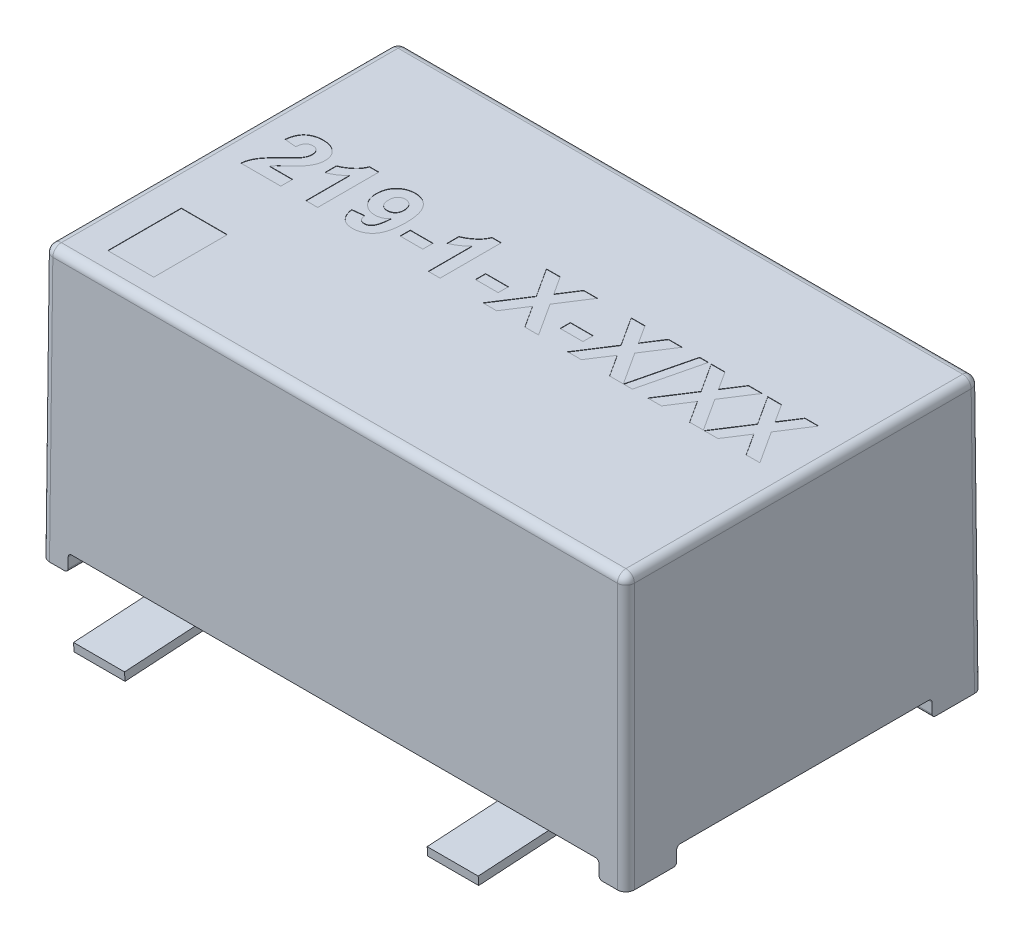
SolidWorks part; units mm, degrees
ref_plane "Front Plane" through (0, 0, 0) normal (0, 0, 1) x (1, 0, 0)
ref_plane "Top Plane" through (0, 0, 0) normal (0, 1, 0) x (1, 0, 0)
ref_plane "Right Plane" through (0, 0, 0) normal (1, 0, 0) x (0, 0, -1)
sketch "Sketch1" plane through (0, 0, 0) normal (0, 1, 0) x (1, 0, 0)
  line L1 (-8.6, -5.25) -> (8.6, -5.25)
  line L2 (-8.6, -5.25) -> (-8.6, 5.25)
  line L3 (-8.6, 5.25) -> (8.6, 5.25)
  line L4 (8.6, -5.25) -> (8.6, 5.25)
  line L5 (-8.6, -5.25) -> (8.6, 5.25) construction
  line L6 (-8.6, 5.25) -> (8.6, -5.25) construction
  point P0 (0, 0)
  dimension "D1" = 17.2
  dimension "D2" = 10.5
extrude "Main Body" add sketch "Sketch1" against normal blind 7.51
sketch "Sketch6" plane through (0, -7.51, 0) normal (0, -1, 0) x (1, 0, 0)
  line L0 (8.6, -5.25) -> (-8.6, -5.25) construction
  line L1 (8.1, 4.75) -> (-8.1, 4.75)
  line L2 (8.1, 4.75) -> (8.1, -4.75)
  line L3 (8.1, -4.75) -> (-8.1, -4.75)
  line L4 (-8.1, 4.75) -> (-8.1, -4.75)
  line L5 (8.1, 4.75) -> (-8.1, -4.75) construction
  line L6 (8.1, -4.75) -> (-8.1, 4.75) construction
  line L7 (-8.6, -5.25) -> (-8.6, 5.25) construction
  point P0 (0, 0)
  dimension "D1" = 0.5
  dimension "D2" = 0.5
sketch "Sketch2" plane through (0, -7.51, 0) normal (0, -1, 0) x (-1, 0, 0)
  line L1 (-8.1, -4.75) -> (-8.1, 4.75) construction
  line L17 (-8.6, 5.25) -> (-7.8, 5.25)
  line L18 (-8.6, 5.25) -> (8.6, 5.25) construction
  line L19 (-7.8, 5.25) -> (-7.8, 4.75)
  line L21 (-7.8, 4.75) -> (-8.1, 4.75)
  line L22 (-8.1, 4.75) -> (-8.1, 3.75)
  line L24 (-8.1, 3.75) -> (-8.6, 3.75)
  line L25 (-8.6, -5.25) -> (-8.6, 5.25) construction
  line L26 (-8.6, 3.75) -> (-8.6, 5.25)
  dimension "D1" = 0.8
  dimension "D2" = 1.5
  dimension "D3" = 0.5
  dimension "D4" = 1
extrude "Stand off foot" add sketch "Sketch2" along normal blind 0.5
mirror "Stand off Mirror1" about plane through (0, 0, 0) normal (1, 0, 0) of "Stand off foot"
mirror "Stand off Mirror2" about plane through (0, 0, 0) normal (0, 0, 1) of "Stand off Mirror1", "Stand off foot"
draft "0.36deg Draft" type of draft neutral plane draft angle 0.36 faces to draft 12 parameters "D1"=0.36
fillet "0.25mm Fillet1" radius 0.25 8 edges at (0, 0, -5.1997) (0, 0, 5.1997) (8.5497, 0, 0) (-8.5497, 0, 0) (-8.5748, -4.005, -5.2248) (-8.5748, -4.005, 5.2248) (8.5748, -4.005, 5.2248) (8.5748, -4.005, -5.2248)
draft "0.36 Inner Wall Draft" type of draft neutral plane draft angle 0.36 faces to draft 4 parameters "D1"=0.36
draft "0.36 Stand off Foot Draft" type of draft neutral plane draft angle 0.36 faces to draft 8 parameters "D1"=0.36
fillet "0.20mm Fillet1" radius 0.1 16 edges at (-8.3484, -7.51, -3.7531) (-8.3516, -8.01, -3.7563) (-7.8063, -8.01, -5) (-7.8031, -7.51, -4.9984) (7.8031, -7.51, -4.9984) (7.8063, -8.01, -5.0016) (8.3484, -7.51, -3.7531) (8.3516, -8.01, -3.7563) (8.3484, -7.51, 3.7531) (8.35, -8.01, 3.7563) (7.8031, -7.51, 4.9984) (7.8063, -8.01, 5) (-7.8063, -8.01, 5.0016) (-8.35, -8.01, 3.7563) (-8.3484, -7.51, 3.7531) (-7.8031, -7.51, 4.9984)
sketch "Sketch7" plane through (0, -7.51, 0) normal (0, -1, 0) x (1, 0, 0)
  line L0 (7.7038, -5.2469) -> (-7.7038, -5.2469) construction
  line L1 (7.55, -4.2069) -> (6.05, -4.2069)
  line L2 (7.55, -4.2069) -> (7.55, -3.9569)
  line L3 (7.55, -3.9569) -> (6.05, -3.9569)
  line L4 (6.05, -4.2069) -> (6.05, -3.9569)
  line L5 (2.85, -4.2069) -> (1.35, -4.2069)
  line L6 (2.85, -4.2069) -> (2.85, -3.9569)
  line L7 (2.85, -3.9569) -> (1.35, -3.9569)
  line L8 (1.35, -4.2069) -> (1.35, -3.9569)
  line L9 (-1.35, -4.2069) -> (-2.85, -4.2069)
  line L10 (-1.35, -4.2069) -> (-1.35, -3.9569)
  line L11 (-1.35, -3.9569) -> (-2.85, -3.9569)
  line L12 (-2.85, -4.2069) -> (-2.85, -3.9569)
  line L13 (-6.05, -4.2069) -> (-7.55, -4.2069)
  line L14 (-6.05, -4.2069) -> (-6.05, -3.9569)
  line L15 (-6.05, -3.9569) -> (-7.55, -3.9569)
  line L16 (-7.55, -4.2069) -> (-7.55, -3.9569)
  line L17 (5.95, 3.9569) -> (4.45, 3.9569)
  line L18 (5.95, 3.9569) -> (5.95, 4.2069)
  line L19 (5.95, 4.2069) -> (4.45, 4.2069)
  line L20 (4.45, 3.9569) -> (4.45, 4.2069)
  line L21 (-4.45, 3.9569) -> (-5.95, 3.9569)
  line L22 (-4.45, 3.9569) -> (-4.45, 4.2069)
  line L23 (-4.45, 4.2069) -> (-5.95, 4.2069)
  line L24 (-5.95, 3.9569) -> (-5.95, 4.2069)
  line L25 (8.6, -5) -> (8.6, -3.8557) construction
  line L26 (-8.6, -5) -> (-8.6, -3.8557) construction
  line L27 (-7.7038, 5.2469) -> (7.7038, 5.2469) construction
  line L28 (8.6, 5) -> (8.6, 3.8557) construction
  line L29 (-8.6, 5) -> (-8.6, 3.8557) construction
  point P34 (-5.95, 4.0819)
  dimension "D1" = 1.5
  dimension "D2" = 0.25
  dimension "D3" = 1.04
  dimension "D4" = 1.05
  dimension "D5" = 3.2
  dimension "D6" = 3.2
  dimension "D7" = 1.05
  dimension "D8" = 1.04
  dimension "D9" = 2.65
  dimension "D10" = 2.65
sketch "Sketch8" plane through (0, -7.51, 0) normal (0, -1, 0) x (-1, 0, 0)
  line L1 (-6.05, 3.9569) -> (-7.55, 3.9569)
  line L2 (-6.05, 3.9569) -> (-6.05, 4.2069)
  line L3 (-6.05, 4.2069) -> (-7.55, 4.2069)
  line L4 (-7.55, 3.9569) -> (-7.55, 4.2069)
  line L5 (-6.05, 3.9569) -> (-7.55, 4.2069) construction
  line L6 (-6.05, 4.2069) -> (-7.55, 3.9569) construction
  point P0 (-6.8, 4.0819)
sketch3d "3DSketch1"
  line L0 (6.8, -7.51, -4.0819) -> (6.8, -7.6072, -4.0819)
  line L1 (6.8, -7.9815, -4.434) -> (6.8, -8.1346, -6.9365)
  arc A0 (6.8, -7.6072, -4.0819) -> (6.8, -7.9815, -4.434) centre (6.8, -7.6072, -4.4569) ccw
  point P6 (6.8, -7.96, -4.0819)
  point P7 (7.175, -7.6072, -4.4569)
  dimension "D2" = 0.375
  dimension "D1" = 93.5
  dimension "D3" = 0.45
  dimension "D4" = 2.86
sweep "Customer Pin 1" add profiles "Sketch8" path "3DSketch1"
pattern_linear "LPattern1" count 2 spacing 4.7 along (-1, 0, 0) of "Customer Pin 1"
ref_plane "Plane1" through (0, 0, 0) normal (-1, 0, 0) x (0, 0, 1)
mirror "Mirror2" about plane through (0, 0, 0) normal (-1, 0, 0) of "LPattern1", "Customer Pin 1"
sketch "Sketch9" plane through (0, -7.51, 0) normal (0, -1, 0) x (1, 0, 0)
  line L1 (4.45, 4.2069) -> (5.95, 4.2069)
  line L2 (4.45, 4.2069) -> (4.45, 3.9569)
  line L3 (4.45, 3.9569) -> (5.95, 3.9569)
  line L4 (5.95, 4.2069) -> (5.95, 3.9569)
  line L5 (4.45, 4.2069) -> (5.95, 3.9569) construction
  line L6 (4.45, 3.9569) -> (5.95, 4.2069) construction
  point P0 (5.2, 4.0819)
sketch3d "3DSketch2"
  line L0 (5.2, -7.51, 4.0819) -> (5.2, -7.6072, 4.0819)
  line L1 (5.2, -7.9815, 4.434) -> (5.2, -8.1346, 6.9365)
  arc A0 (5.2, -7.6072, 4.0819) -> (5.2, -7.9815, 4.434) centre (5.2, -7.6072, 4.4569) ccw
  point P6 (5.2, -7.96, 4.0819)
  point P7 (4.825, -7.6072, 4.4569)
  dimension "D2" = 0.375
  dimension "D1" = 93.5
  dimension "D3" = 0.45
  dimension "D4" = 2.86
sweep "Customer Pin 2" add profiles "Sketch9" path "3DSketch2"
mirror "Mirror3" about plane through (0, 0, 0) normal (-1, 0, 0) of "Customer Pin 2"
sketch "Sketch10" plane through (0, 0, 0) normal (0, 1, 0) x (1, 0, 0)
  line L0 (-7.7815, -0.2864) -> (10.4709, -0.2864) construction
  line L1 (-7.4155, -2.3074) -> (-6.0629, -2.3074)
  line L2 (-7.4155, -2.3074) -> (-7.4155, -4.4716)
  line L3 (-7.4155, -4.4716) -> (-6.0629, -4.4716)
  line L4 (-6.0629, -2.3074) -> (-6.0629, -4.4716)
  text T0 "219-1-X-X/XX" font "Arial" height 1.8
extrude "Text" cut sketch "Sketch10" against normal blind 0.01
sketch "Sketch11" plane through (0, -7.51, 0) normal (0, -1, 0) x (1, 0, 0)
  line L1 (7.55, -3.9569) -> (6.05, -3.9569)
  line L2 (7.55, -3.9569) -> (7.55, -6.9442)
  line L3 (7.55, -6.9442) -> (6.05, -6.9442)
  line L4 (6.05, -3.9569) -> (6.05, -6.9442)
  line L5 (-6.05, -3.9569) -> (-7.55, -3.9569)
  line L6 (-6.05, -3.9569) -> (-6.05, -6.9442)
  line L7 (-6.05, -6.9442) -> (-7.55, -6.9442)
  line L8 (-7.55, -3.9569) -> (-7.55, -6.9442)
extrude "SW2 Pins Removed" cut sketch "Sketch11" along normal blind 10
